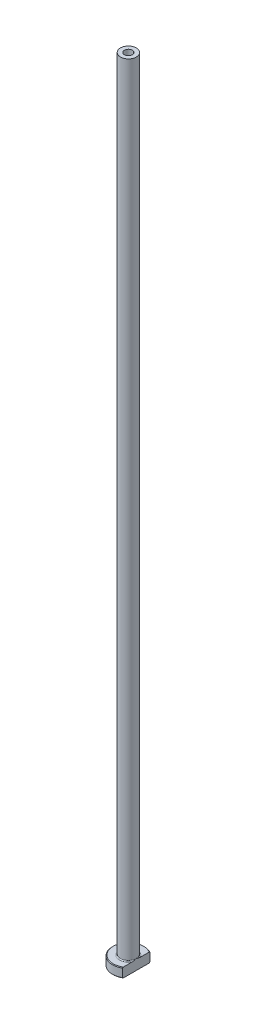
SolidWorks part; units mm, degrees
ref_plane "Front Plane" through (0, 0, 0) normal (0, 0, 1) x (1, 0, 0)
ref_plane "Top Plane" through (0, 0, 0) normal (0, 1, 0) x (1, 0, 0)
ref_plane "Right Plane" through (0, 0, 0) normal (1, 0, 0) x (0, 0, -1)
sketch "Sketch1" plane through (0, 0, 0) normal (0, 0, 1) x (1, 0, 0)
  line L0 (-1.25, 250) -> (-2.5, 250)
  line L1 (-2.5, 250) -> (-2.5, 3)
  line L2 (-2.5, 3) -> (-5, 3)
  line L3 (-5, 3) -> (-5, 0)
  line L4 (4.125, 0) -> (-4.125, 0) construction
  line L5 (-5, 0) -> (-1.5, 0)
  line L6 (-1.25, 215) -> (-1.25, 250)
  line L7 (0, 92.1877) -> (0, -15.5353) construction
  line L8 (0, -5.5) -> (0, 5.5) construction
  line L9 (-1.25, 215) -> (-1.5, 203)
  line L10 (-1.5, 203) -> (-1.5, 0)
  dimension "D1" = 0.25
  dimension "ID" = 2.5
  dimension "OD" = 5
  dimension "L" = 250
  dimension "H" = 10
  dimension "T" = 3
  dimension "N" = 35
  dimension "D2" = 12
  dimension "L-N" = 215
revolve "Revolve1" add sketch "Sketch1" angle 360 about L7
fillet "Fillet1" radius 0.3 1 edges at (0, 3, 2.5)
chamfer "Chamfer1" distance 0.2 angle 45 2 edges at (0, 3, 5) (0, 0, 5)
sketch "Sketch2" plane through (0, 0, 0) normal (0, -1, 0) x (1, 0, 0)
  line L0 (2.5, 4.3301) -> (2.5, -4.3301)
  circle A0 centre (0, 0) radius 5 construction
  arc A1 (2.5, 4.3301) -> (2.5, -4.3301) centre (0, 0) cw
  circle A2 centre (0, 0) radius 2.5 construction
extrude "Cut-Extrude1" cut sketch "Sketch2" against normal through all
chamfer "Chamfer2" distance 0.5 angle 45 1 edges at (0, 0, 1.5)
